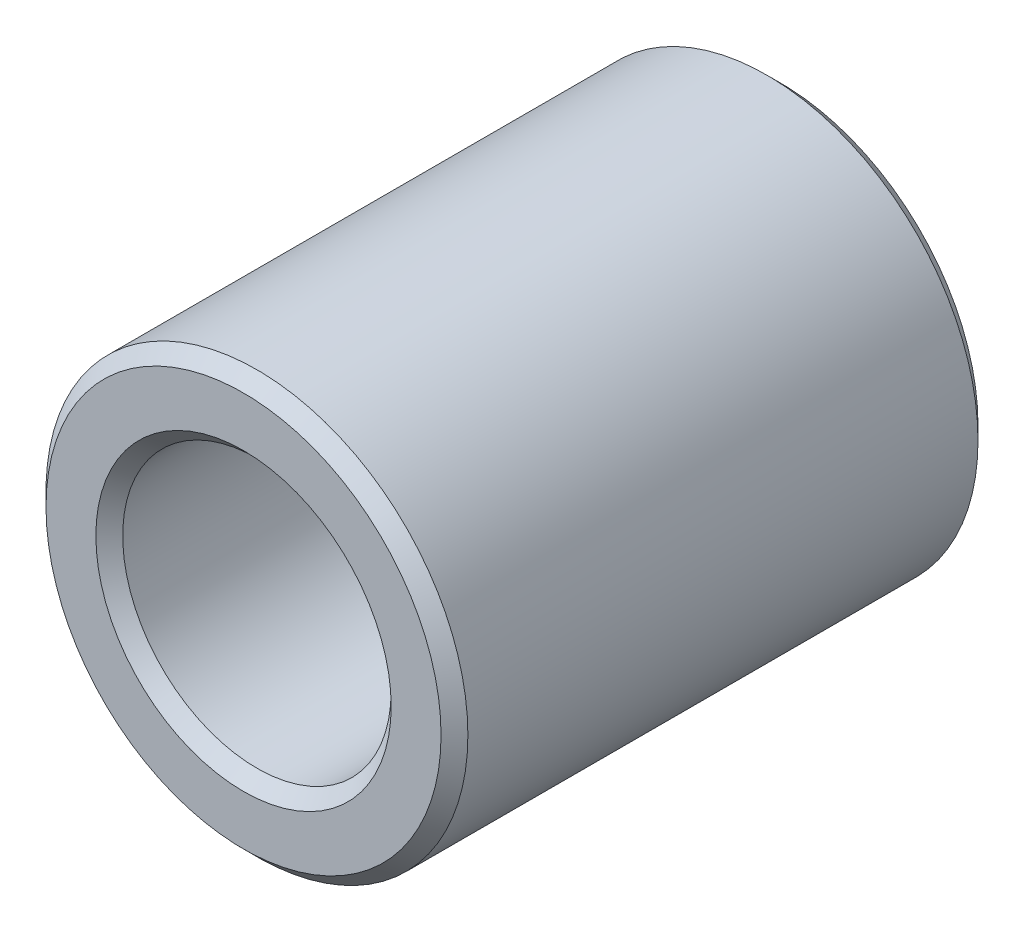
SolidWorks part; units mm, degrees
ref_plane "Front Plane" through (0, 0, 0) normal (0, 0, 1) x (1, 0, 0)
ref_plane "Top Plane" through (0, 0, 0) normal (0, 1, 0) x (1, 0, 0)
ref_plane "Right Plane" through (0, 0, 0) normal (1, 0, 0) x (0, 0, -1)
sketch "Sketch1" plane through (0, 0, 0) normal (0, 0, 1) x (1, 0, 0)
  circle A0 centre (0, 0) radius 35
  circle A1 centre (0, 0) radius 55
  dimension "D1" = 70
  dimension "D2" = 110
extrude "Boss-Extrude1" add sketch "Sketch1" along normal mid plane 140
chamfer "Chamfer1" distance 3.5 angle 45 4 edges at (35, 0, -70) (55, 0, -70) (35, 0, 70) (55, 0, 70)
